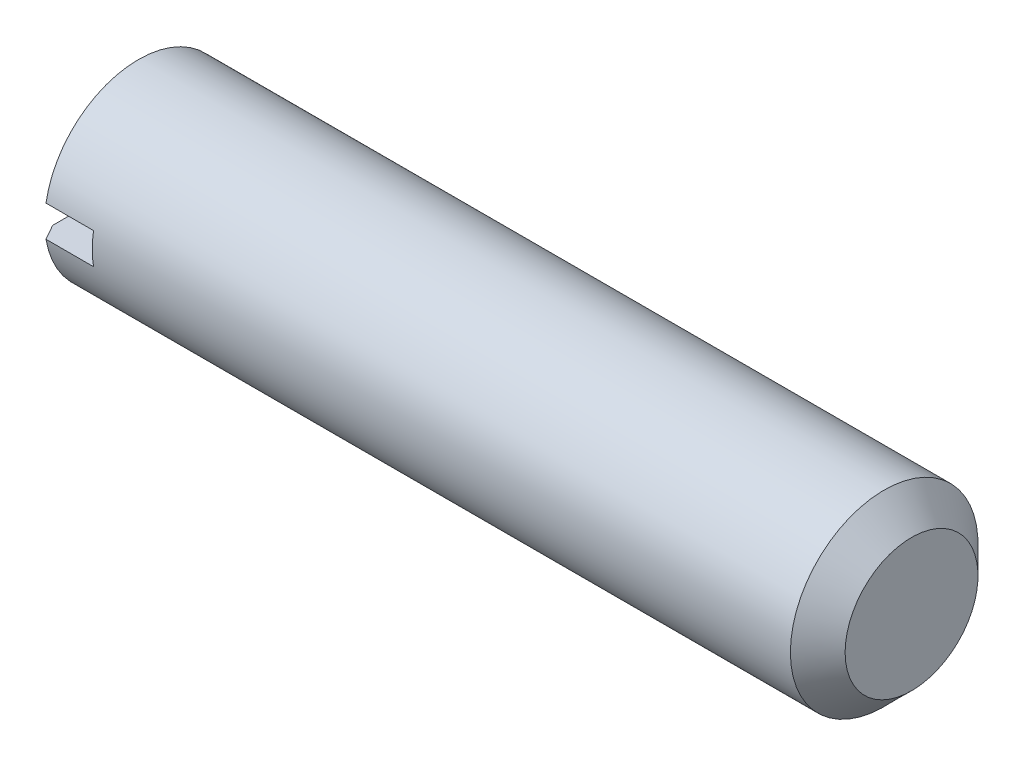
SolidWorks part; units mm, degrees
revolve "BaseBody" add sketch "BodySke"
sketch "BodySke" plane through (0, 0, 0) normal (0, 0, 1) x (1, 0, 0)
  line L0 (0.5566, -6) -> (47.1574, -6) construction
  line L1 (50, 0) -> (50, 4.25)
  line L2 (0.5566, 6) -> (48.25, 6)
  line L3 (50, 4.25) -> (48.25, 6)
  line L4 (50, 0) -> (0, 0)
  line L5 (-12.7, 0) -> (88.9, 0) construction
  line L6 (50, 4.25) -> (50, 19.05) construction
  line L7 (50, -4.25) -> (48.25, -6) construction
  line L8 (1.75, 12.7) -> (1.75, -3.175) construction
  line L9 (0, 0) -> (0, 5.036)
  line L10 (0, 5.036) -> (0.5566, 6)
  line L11 (0, -5.036) -> (0.5566, -6) construction
extrude "Slot" cut sketch "Sketch2" along normal blind 3.6
sketch "Sketch2" plane through (0, 0, 0) normal (1, 0, 0) x (0, 0, -1)
  line L1 (6, -1) -> (-6, -1)
  line L2 (6, -1) -> (6, 1)
  line L3 (6, 1) -> (-6, 1)
  line L4 (-6, -1) -> (-6, 1)
ref_plane "Plane1" through (0, 0, 0) normal (0, 0, 1) x (1, 0, 0)
ref_plane "Plane2" through (0, 0, 0) normal (0, 1, 0) x (1, 0, 0)
ref_plane "Plane3" through (0, 0, 0) normal (1, 0, 0) x (0, 0, -1)
other "Configuration Table"
sketch "ThdSchSke" plane through (0, 0, 0) normal (0, 0, 1) x (1, 0, 0)
  line L0 (0.5566, -5.036) -> (-0.1184, -6)
  line L1 (0.5566, -5.036) -> (1.2316, -6)
  line L2 (1.2316, -6) -> (1.2316, -7.5)
  line L3 (-3.175, 0) -> (5.1513, 0) construction
  line L5 (1.2316, -7.5) -> (-0.1184, -7.5)
  line L6 (-0.1184, -7.5) -> (-0.1184, -6)
  line L7 (0.5566, -6) -> (0.5566, -1) construction
revolve "ThreadSchematic" [suppressed] cut sketch "ThdSchSke" angle 360 about L3
pattern_linear "ThdSchPat" [suppressed]
equation "\"D1@Sketch2\" = \"Diameter@BodySke\""
equation "\"D3@Sketch2\" = \"D1@Sketch2\" / 2"
equation "\"D2@Sketch2\" = \"Slot_width@Sketch2\" / 2"
equation "\"Thread_minor@ThdSchSke\" = \"Minor_dia@BodySke\""
equation "\"Diameter@ThdSchSke\" = \"Diameter@BodySke\""
equation "\"Overcut@ThdSchSke\" = \"Diameter@BodySke\" * 1.25"
equation "\"Num_threads@ThdSchPat\" = int( (\"Length@BodySke\" - ( ( ( \"Diameter@BodySke\" - \"Minor_dia@BodySke\" ) * 0.5 ) / tan( \"Drive_ch_ang@BodySke\" * 0.017453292 ) ) - ( ( ( \"Diameter@BodySke\" - \"Cup_dia@BodySk"
equation "\"Advance@ThdSchPat\" = (\"Length@BodySke\" - ( ( ( \"Diameter@BodySke\" - \"Minor_dia@BodySke\" ) * 0.5 ) / tan( \"Drive_ch_ang@BodySke\" * 0.017453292 ) ) - ( ( ( \"Diameter@BodySke\" - \"Cup_dia@BodySke\" ) * 0."
equation "' \"Num_threads@ThdSchPat\" = \"Num_threads@ThdSchPat\" - sgn( \"Num_threads@ThdSchPat\" - 1) '---chamfered tips only---"
